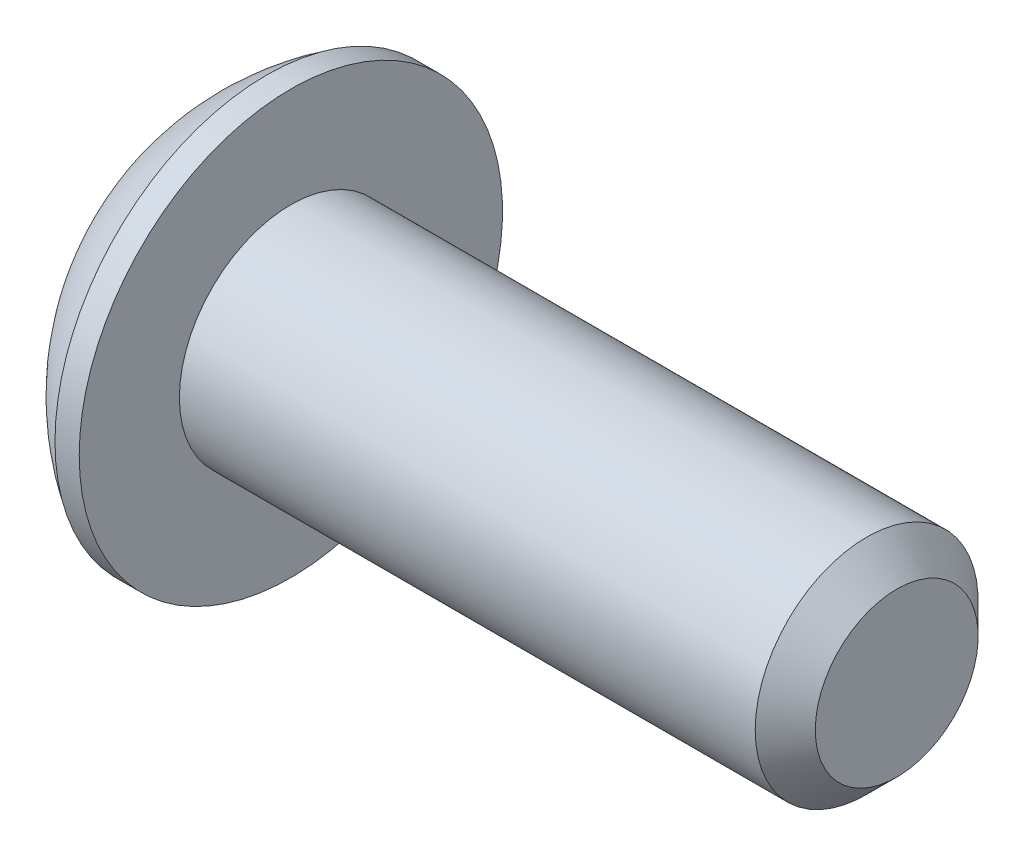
SolidWorks part; units mm, degrees
ref_plane "Plane1" through (0, 0, 0) normal (0, 0, 1) x (1, 0, 0)
ref_plane "Plane2" through (0, 0, 0) normal (0, 1, 0) x (1, 0, 0)
ref_plane "Plane3" through (0, 0, 0) normal (1, 0, 0) x (0, 0, -1)
revolve "BaseBody" add sketch "BodySke" angle 360 about L4
sketch "BodySke" plane through (0, 0, 0) normal (0, 0, 1) x (1, 0, 0)
  line L0 (11.3792, 0) -> (11.3792, 1.2802)
  line L1 (10.9068, 1.7526) -> (1.8542, 1.7526)
  line L2 (1.8542, 1.7526) -> (1.8542, 3.3274)
  line L3 (1.8542, 3.3274) -> (1.4732, 3.3274)
  line L4 (0, 0) -> (101.6, 0) construction
  line L5 (1.8542, -3.3274) -> (1.4732, -3.3274) construction
  line L6 (55.6768, -1.7526) -> (1.8542, -1.7526) construction
  line L7 (11.3792, 0) -> (0, 0)
  line L8 (0, 1.6637) -> (0, -1.6637) construction
  line L9 (0, 0) -> (0, 1.6637)
  line L10 (11.3792, 1.2802) -> (10.9068, 1.7526)
  line L11 (11.3792, -1.2802) -> (10.9068, -1.7526) construction
  line L12 (2.6467, 9.525) -> (2.6467, -1.7526) construction
  line L13 (1.8542, 9.525) -> (1.8542, -1.7526) construction
  arc A1 (0, 1.6637) -> (1.4732, 3.3274) centre (3.5549, 0) cw
  dimension "D1" = 3.3274
  dimension "Diameter" = 3.5052
  dimension "Length" = 9.525
  dimension "Head_dia" = 6.6548
  dimension "Head_ht" = 1.8542
  dimension "Head_side_ht" = 0.381
  dimension "Minor_dia" = 2.5603
  dimension "Body_ch_ang" = 45
  dimension "Advance" = 0.7925
  dimension "Thread_nom" = 9.525
sketch "Sketch2" plane through (0, 0, 0) normal (0, 0, 1) x (1, 0, 0)
  line L0 (0, 0.9906) -> (1.1176, 0.9906)
  line L1 (1.1176, 0.9906) -> (1.6895, 0)
  line L3 (1.6895, 0) -> (0, 0)
  line L4 (0, 0) -> (0, 0.9906)
  line L5 (0, -0.9906) -> (1.1176, -0.9906) construction
  line L6 (0, 0) -> (47.625, 0) construction
  dimension "D2" = 60
  dimension "PreBroach_depth" = 1.1176
  dimension "PreBroach_dia" = 1.9812
revolve "PreBroach" cut sketch "Sketch2" angle 360 about L6
sketch "Sketch3" plane through (0, 0, 0) normal (1, 0, 0) x (0, 0, -1)
  line L0 (-0.9906, -0.5719) -> (-0.9906, 0.5719)
  line L1 (-0.9906, 0.5719) -> (0, 1.1438)
  line L2 (0, 1.1438) -> (0.9906, 0.5719)
  line L3 (0.9906, 0.5719) -> (0.9906, -0.5719)
  line L4 (0.9906, -0.5719) -> (0, -1.1438)
  line L5 (0, -1.1438) -> (-0.9906, -0.5719)
  dimension "D1" = 0.9906
  dimension "D2" = 0.9906
  dimension "D3" = 1.9812
  dimension "Hex_size" = 1.9812
extrude "Hex" cut sketch "Sketch3" along normal blind 1.1176
sketch "Sketch4" plane through (0, 9.525, 0) normal (1, 0, 0) x (0, 0, -1)
  line L0 (0, -9.525) -> (1.2446, -9.525)
  line L1 (0, -9.525) -> (6.1484, -5.9752) construction
  line L2 (0, -9.525) -> (0.6223, -8.4471)
  line L3 (1.0085, -9.2654) -> (1.19, -9.1606)
  line L4 (0.7291, -8.7814) -> (0.9106, -8.6766)
  arc A0 (1.0085, -9.2654) -> (0.7291, -8.7814) centre (0, -9.525) ccw
  arc A1 (1.2446, -9.525) -> (1.19, -9.1606) centre (0, -9.525) ccw
  arc A2 (0.6223, -8.4471) -> (0.9106, -8.6766) centre (0, -9.525) cw
  dimension "D1" = 30
  dimension "Spline_n_dim" = 2.0828
  dimension "Spline_m_dim" = 2.4892
  dimension "D2" = 60
  dimension "D3" = 0.2794
  dimension "Spline_p_dim" = 0.5588
extrude "Spline" [suppressed] cut sketch "Sketch4" along normal blind 1.1176
pattern_circular "CirPattern1" [suppressed] count 6 every 60 about axis through (0, 0, 0) along (1, 0, 0)
sketch "ThdSchSke" plane through (0, 0, 0) normal (0, 0, 1) x (1, 0, 0)
  line L0 (2.6467, -1.2802) -> (2.3159, -1.7526)
  line L1 (2.6467, -1.2802) -> (2.9775, -1.7526)
  line L2 (2.9775, -1.7526) -> (2.9775, -2.1908)
  line L3 (-3.175, 0) -> (5.1513, 0) construction
  line L5 (2.9775, -2.1908) -> (2.3159, -2.1908)
  line L6 (2.3159, -2.1908) -> (2.3159, -1.7526)
  dimension "Thread_minor" = 2.5603
  dimension "Diameter" = 3.5052
  dimension "Start" = 2.6467
  dimension "SideAngle" = 55
  dimension "VeeAngle" = 70
  dimension "Overcut" = 4.3815
revolve "ThreadSchematic" [suppressed] cut sketch "ThdSchSke" angle 360 about L3
pattern_linear "ThdSchPat" [suppressed]
equation "\"D1@BodySke\" = \"Head_dia@BodySke\" * .5"
equation "\"Thread_minor@ThreadCosmetic\" = \"Minor_dia@BodySke\""
equation "\"D1@Sketch3\" = \"Hex_size@Sketch3\" / 2"
equation "\"D2@Sketch3\" = \"D1@Sketch3\""
equation "\"D3@Sketch3\" = \"Hex_size@Sketch3\""
equation "\"D3@Sketch4\" = \"Spline_p_dim@Sketch4\" / 2"
equation "\"D1@Sketch4\" = \"D2@Sketch4\" / 2"
equation "\"Thread_length@ThreadCosmetic\" = ((sgn( (\"Length@BodySke\" - \"Advance@BodySke\" ) - \"Thread_nom@BodySke\" )-1)*( (\"Length@BodySke\" - \"Advance@BodySke\" ) - \"Thread_nom@BodySke\" ))/-2+ \"Thread_nom@BodySke\""
equation "\"Thread_minor@ThdSchSke\" = \"Minor_dia@BodySke\""
equation "\"Diameter@ThdSchSke\" = \"Diameter@BodySke\""
equation "\"Overcut@ThdSchSke\" = \"Diameter@BodySke\" * 1.25"
equation "\"Start@ThdSchSke\" = \"Head_ht@BodySke\" + \"Length@BodySke\" - \"Thread_length@ThreadCosmetic\"  '---Non-countersunk---"
equation "\"Num_threads@ThdSchPat\" = int( \"Thread_length@ThreadCosmetic\" / \"Advance@BodySke\" + 0.999 )  + 1"
equation "\"Advance@ThdSchPat\" = \"Thread_length@ThreadCosmetic\" /  (\"Num_threads@ThdSchPat\" - 1) 'relax it"
equation "\"Num_threads@ThdSchPat\" = \"Num_threads@ThdSchPat\" - sgn( \"Num_threads@ThdSchPat\" - 1) '---chamfered tips only---"
